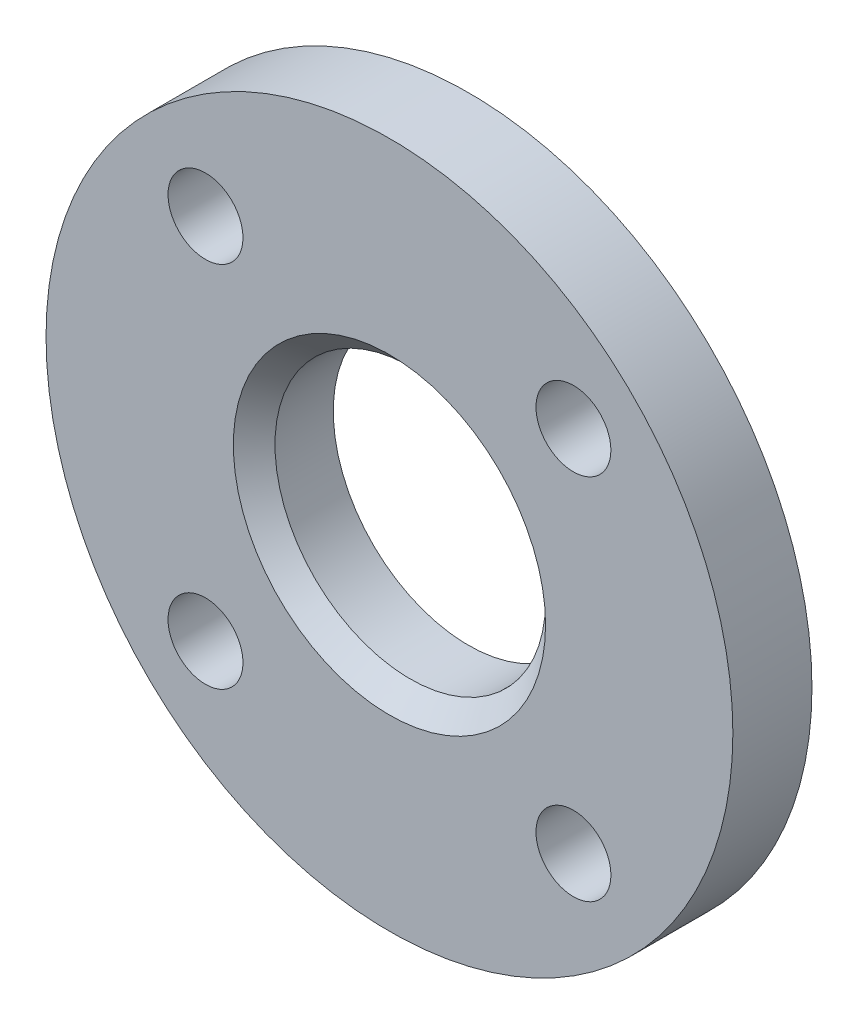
SolidWorks part; units mm, degrees
ref_plane "Front" through (0, 0, 0) normal (0, 0, 1) x (1, 0, 0)
ref_plane "Top" through (0, 0, 0) normal (0, 1, 0) x (1, 0, 0)
ref_plane "Right" through (0, 0, 0) normal (1, 0, 0) x (0, 0, -1)
sketch "Sketch1" plane through (0, 0, 0) normal (0, 0, 1) x (1, 0, 0)
  circle A0 centre (0, 0) radius 82.5
  circle A1 centre (0, 0) radius 32.5
  dimension "D1" = 165
  dimension "D2" = 65
extrude "Extrude1" add sketch "Sketch1" along normal blind 19
chamfer "Chamfer1" distance 5 angle 45 1 edges at (32.5, 0, 19)
sketch "Sketch2" plane through (0, 0, 19) normal (0, 0, 1) x (1, 0, 0)
  line L0 (0, 108.4216) -> (0, 0) construction
  line L1 (0, 0) -> (44.1942, 44.1942) construction
  circle A0 centre (0, 0) radius 62.5 construction
  circle A1 centre (44.1942, 44.1942) radius 9
  dimension "D1" = 125
  dimension "D2" = 18
  dimension "D3" = 45
extrude "Cut-Extrude1" cut sketch "Sketch2" against normal through all
pattern_circular "CirPattern1" count 4 over 360 about axis through (0, 0, 0) along (0, 0, 1) of "Cut-Extrude1"
